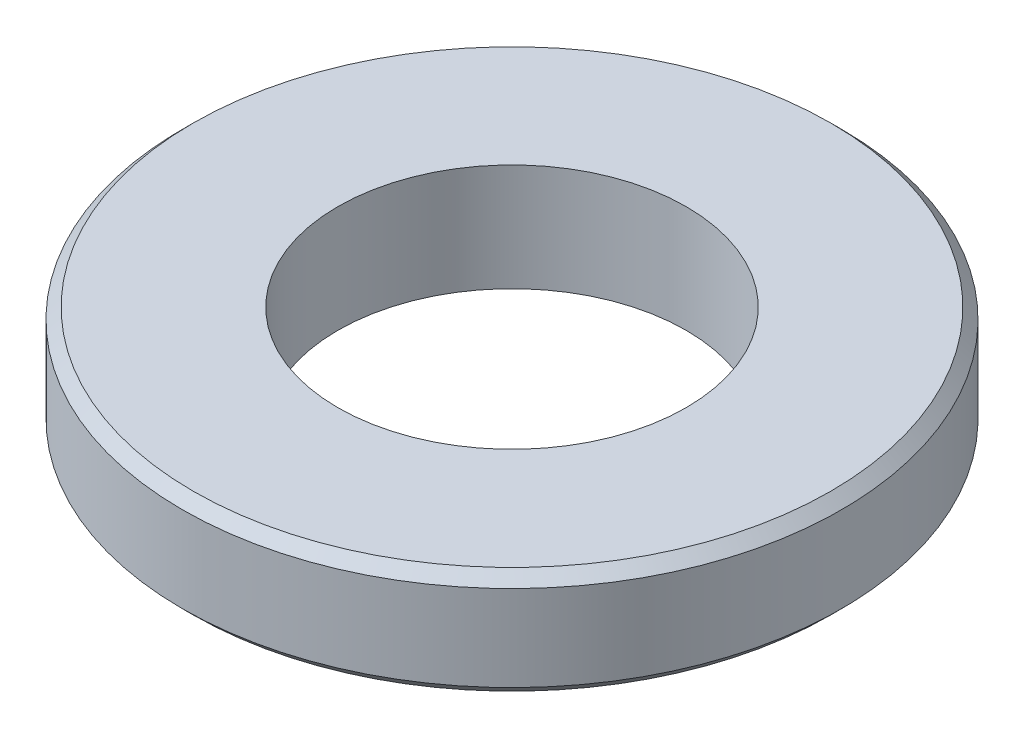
SolidWorks part; units mm, degrees
ref_plane "Front Plane" through (0, 0, 0) normal (0, 0, 1) x (1, 0, 0)
ref_plane "Top Plane" through (0, 0, 0) normal (0, 1, 0) x (1, 0, 0)
ref_plane "Right Plane" through (0, 0, 0) normal (1, 0, 0) x (0, 0, -1)
sketch "Sketch1" plane through (0, 0, 0) normal (0, 1, 0) x (1, 0, 0)
  circle A0 centre (0, 0) radius 6.5
  circle A1 centre (0, 0) radius 12.3
  dimension "D1" = 13
  dimension "D2" = 24.6
extrude "Boss-Extrude1" add sketch "Sketch1" along normal blind 4
chamfer "Chamfer1" distance 0.4 angle 45 2 edges at (0, 0, 12.3) (0, 4, 12.3)
